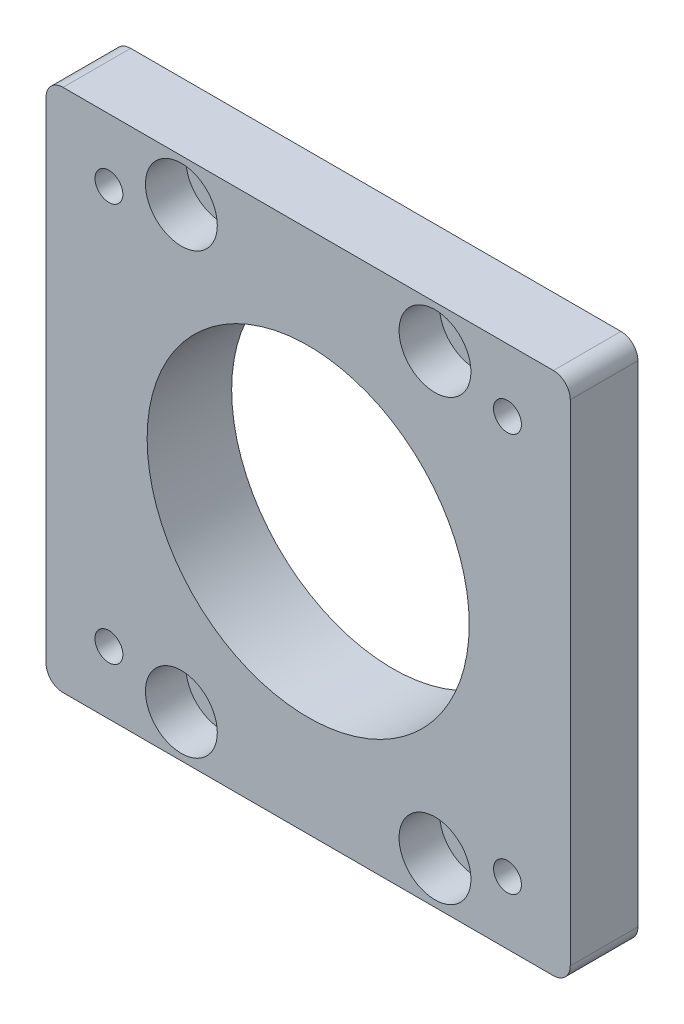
SolidWorks part; units mm, degrees
ref_plane "前视基准面" through (0, 0, 0) normal (0, 0, 1) x (1, 0, 0)
ref_plane "上视基准面" through (0, 0, 0) normal (0, 1, 0) x (1, 0, 0)
ref_plane "右视基准面" through (0, 0, 0) normal (1, 0, 0) x (0, 0, -1)
sketch "草图1" plane through (0, 0, 0) normal (0, 0, 1) x (1, 0, 0)
  line L1 (-31, -31) -> (31, -31)
  line L2 (-31, -31) -> (-31, 31)
  line L3 (-31, 31) -> (31, 31)
  line L4 (31, -31) -> (31, 31)
  line L5 (-31, -31) -> (31, 31) construction
  line L6 (-31, 31) -> (31, -31) construction
  circle A0 centre (0, 0) radius 19.05
  point P0 (0, 0)
  dimension "D3" = 38.1
  dimension "D1" = 62
  dimension "D2" = 62
extrude "凸台-拉伸1" add sketch "草图1" along normal blind 8
sketch "草图2" plane through (0, 0, 8) normal (0, 0, 1) x (1, 0, 0)
  line L0 (0, 31) -> (0, 0) construction
  line L1 (31, 31) -> (-31, 31) construction
  line L2 (0, 0) -> (-31, 0) construction
  line L3 (-31, 31) -> (-31, -31) construction
  line L4 (-23.5714, 23.5714) -> (23.5714, -23.5714) construction
  line L5 (23.5714, 23.5714) -> (-23.5714, -23.5714) construction
  circle A0 centre (-23.5714, 23.5714) radius 1.25
  circle A1 centre (23.5714, 23.5714) radius 1.25
  circle A2 centre (23.5714, -23.5714) radius 1.25
  circle A3 centre (-23.5714, -23.5714) radius 1.25
  circle A4 centre (0, 0) radius 33.335 construction
  dimension "D1" = 66.67
  dimension "D2" = 45
  dimension "D3" = 2.5
  dimension "D4" = 45
extrude "切除-拉伸1" cut sketch "草图2" against normal through all
sketch "草图5" plane through (0, 0, 8) normal (0, 0, 1) x (1, 0, 0)
  line L0 (0, 30) -> (0, 0) construction
  line L1 (0, 0) -> (-30, 0) construction
  line L2 (-15, 25.9808) -> (15, -25.9808) construction
  line L3 (15, 25.9808) -> (-15, -25.9808) construction
  circle A0 centre (0, 0) radius 30 construction
  circle A1 centre (-15, 25.9808) radius 2.25
  circle A2 centre (15, 25.9808) radius 2.25
  circle A3 centre (15, -25.9808) radius 2.25
  circle A4 centre (-15, -25.9808) radius 2.25
  dimension "D3" = 60
  dimension "D4" = 4.5
  dimension "D1" = 30
  dimension "D2" = 30
extrude "切除-拉伸3" cut sketch "草图5" against normal through all
sketch "草图6" plane through (0, 0, 8) normal (0, 0, 1) x (1, 0, 0)
  circle A0 centre (-15, 25.9808) radius 4.25
  circle A1 centre (15, 25.9808) radius 4.25
  circle A2 centre (15, -25.9808) radius 4.25
  circle A3 centre (-15, -25.9808) radius 4.25
  dimension "D1" = 8.5
extrude "切除-拉伸4" cut sketch "草图6" against normal blind 4.8
fillet "圆角1" radius 2 4 edges at (-31, 31, 4) (-31, -31, 4) (31, -31, 4) (31, 31, 4)
sketch "草图7" plane through (0, 0, 0) normal (0, 0, -1) x (-1, 0, 0)
  circle A0 centre (0, 0) radius 19.05 construction
  circle A1 centre (0, 0) radius 19.05
  circle A2 centre (0, 0) radius 25
  dimension "D1" = 50
extrude "凸台-拉伸2" add sketch "草图7" along normal blind 2
hole_wizard "M4 螺纹孔1" positions "草图9" profile "草图8" tap size "M4" standard "GB"
sketch "草图9" plane through (0, 0, 8) normal (0, 0, 1) x (1, 0, 0)
  point P0 (-23.5714, 23.5714)
  point P3 (-23.5714, -23.5714)
  point P6 (23.5714, -23.5714)
  point P9 (23.5714, 23.5714)
sketch "草图8" plane through (-23.5714, 23.5714, 8) normal (1, 0, 0) x (0, -1, 0)
  line L0 (0, 0) -> (0, 14.3914)
  line L1 (0, 14.3914) -> (1.65, 13.4)
  line L2 (1.65, 13.4) -> (1.65, 0)
  line L5 (1.65, 0) -> (0, 0)
  line L10 (0, 14.3914) -> (-1.65, 13.4) construction
  line L11 (0, -6.35) -> (0, 107.95) construction
  dimension "螺纹孔钻头直径" = 3.3
  dimension "螺纹孔钻头深度" = 13.4
  dimension "导头角度" = 118
